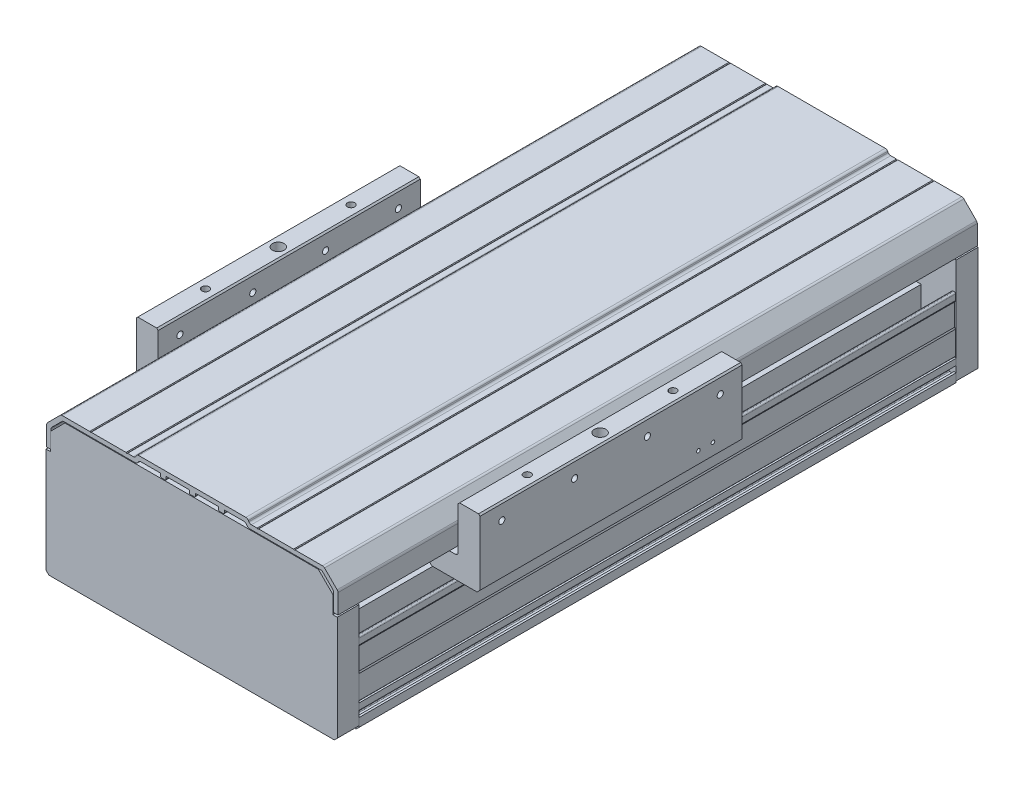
SolidWorks part; units mm, degrees
ref_plane "정면" through (0, 0, 0) normal (0, 0, 1) x (1, 0, 0)
ref_plane "윗면" through (0, 0, 0) normal (0, 1, 0) x (1, 0, 0)
ref_plane "우측면" through (0, 0, 0) normal (1, 0, 0) x (0, 0, -1)
sketch "스케치1" plane through (0, 0, 0) normal (0, 0, 1) x (1, 0, 0)
  line L0 (-99, 33.5) -> (-99, 48.5)
  line L1 (-97, 16.5) -> (-97, 53.5)
  line L2 (-99.5, 16.5) -> (-99.5, 32.5)
  line L3 (-97.5, 16) -> (-99, 16)
  line L4 (-99, 33.5) -> (-99.5, 32.5)
  line L5 (-98.5, 54.5) -> (-98, 54.5)
  line L6 (-99.5, 49.5) -> (-99.5, 53.5)
  line L7 (-99, 48.5) -> (-99.5, 49.5)
  line L8 (99, 33.5) -> (99, 48.5)
  line L9 (97, 16.5) -> (97, 53.5)
  line L10 (99.5, 16.5) -> (99.5, 32.5)
  line L11 (97.5, 16) -> (99, 16)
  line L12 (99, 33.5) -> (99.5, 32.5)
  line L13 (98.5, 54.5) -> (98, 54.5)
  line L14 (99.5, 49.5) -> (99.5, 53.5)
  line L15 (99, 48.5) -> (99.5, 49.5)
  line L16 (-78, 44.5) -> (-43.5, 44.5)
  line L17 (-36, -1) -> (-98, -1)
  line L18 (-66.55, 32.5) -> (-54.5, 32.5)
  line L19 (-100, 1) -> (-98, -1)
  line L20 (-78, 44.5) -> (-78, 37.5)
  line L21 (-69.5, 14.5) -> (-69.5, 30.0927)
  line L22 (-77.7, 37) -> (-78, 36.5)
  line L23 (-78, 37.5) -> (-77.7, 37)
  line L24 (-78, 26.5) -> (-77.1807, 25.0809)
  line L25 (-78, 36.5) -> (-78, 26.5)
  line L26 (-97, 21) -> (-97, 15.5)
  line L27 (-97, 25.5) -> (-97, 22)
  line L28 (-97, 15.5) -> (-100, 15.5)
  line L29 (36, -1) -> (98, -1)
  line L30 (35, 0) -> (-35, 0)
  line L31 (-35, 0) -> (-36, -1)
  line L32 (36, -1) -> (35, 0)
  line L33 (100, 1) -> (98, -1)
  line L34 (-16.9019, 9.5) -> (-14.3038, 11)
  line L35 (-14.3038, 5) -> (-16.9019, 6.5)
  line L36 (-22.5, 16) -> (22.5, 16)
  line L37 (-23, 16.5) -> (-22.5, 16)
  line L38 (-16.9019, 9.5) -> (-18.0629, 9.5)
  line L39 (-16.9019, 6.5) -> (-18.0629, 6.5)
  line L40 (-52.5, 30.5) -> (-52.5, 16.25)
  line L41 (-52, 15.75) -> (-51.4079, 15.75)
  line L42 (-51.6685, 12.5) -> (-67.5, 12.5)
  line L43 (-38.5, 16.5) -> (-23, 16.5)
  line L44 (22.5, 16) -> (23, 16.5)
  line L45 (23, 16.5) -> (38.5, 16.5)
  line L46 (16.9019, 9.5) -> (14.3038, 11)
  line L47 (14.3038, 5) -> (16.9019, 6.5)
  line L48 (16.9019, 9.5) -> (18.0629, 9.5)
  line L49 (16.9019, 6.5) -> (18.0629, 6.5)
  line L50 (-4, 9) -> (4, 9)
  line L51 (-7.3333, 11) -> (-4, 9)
  line L52 (7.3333, 11) -> (4, 9)
  line L53 (-14.3038, 11) -> (-7.3333, 11)
  line L54 (-14.3038, 5) -> (14.3038, 5)
  line L55 (7.3333, 11) -> (14.3038, 11)
  line L56 (43.5, 22.5) -> (43.5, 44.5)
  line L57 (97, 21) -> (97, 15.5)
  line L58 (97, 15.5) -> (100, 15.5)
  line L59 (97, 25.5) -> (97, 22)
  line L60 (95, 25.5) -> (97, 25.5)
  line L61 (95, 24) -> (95, 25.5)
  line L62 (71, 47.5) -> (71, 44.5)
  line L63 (71, 47.5) -> (76, 47.5)
  line L64 (71, 44.5) -> (43.5, 44.5)
  line L65 (100, 1) -> (100, 6.85)
  line L66 (98.5, 11.15) -> (100, 11.15)
  line L67 (98.5, 12.65) -> (98.5, 11.15)
  line L68 (95.5, 12.65) -> (98.5, 12.65)
  line L69 (95, 5.85) -> (95, 12.15)
  line L70 (98.5, 5.35) -> (95.5, 5.35)
  line L71 (98.5, 6.85) -> (98.5, 5.35)
  line L72 (100, 6.85) -> (98.5, 6.85)
  line L73 (100, 11.15) -> (100, 15.5)
  line L74 (-100, 1) -> (-100, 6.85)
  line L75 (-98.5, 11.15) -> (-100, 11.15)
  line L76 (-98.5, 12.65) -> (-98.5, 11.15)
  line L77 (-95.5, 12.65) -> (-98.5, 12.65)
  line L78 (-95, 5.85) -> (-95, 12.15)
  line L79 (-98.5, 5.35) -> (-95.5, 5.35)
  line L80 (-98.5, 6.85) -> (-98.5, 5.35)
  line L81 (-100, 6.85) -> (-98.5, 6.85)
  line L82 (-100, 11.15) -> (-100, 15.5)
  line L83 (38.5, 17.5) -> (38.5, 16.5)
  line L84 (-43.5, 22.5) -> (-43.5, 44.5)
  line L85 (-38.5, 17.5) -> (-38.5, 16.5)
  line L86 (80.8, 21) -> (79.5, 21)
  line L87 (79.5, 18) -> (93.5, 18)
  line L88 (79.5, 21) -> (79.5, 18)
  line L89 (92, 21.2) -> (92, 22.8)
  line L90 (92.2, 21) -> (92, 21.2)
  line L91 (93.5, 21) -> (92.2, 21)
  line L92 (92.2, 23) -> (94, 23)
  line L93 (92, 22.8) -> (92.2, 23)
  line L94 (93.5, 18) -> (93.5, 21)
  line L95 (81, 22.8) -> (81, 21.2)
  line L96 (81, 21.2) -> (80.8, 21)
  line L97 (80.8, 23) -> (81, 22.8)
  line L98 (78.4, 23) -> (80.8, 23)
  line L99 (-95, 25.5) -> (-97, 25.5)
  line L100 (-95, 24) -> (-95, 25.5)
  line L101 (-80.8, 21) -> (-79.5, 21)
  line L102 (-79.5, 18) -> (-93.5, 18)
  line L103 (-79.5, 21) -> (-79.5, 18)
  line L104 (-92, 21.2) -> (-92, 22.8)
  line L105 (-92.2, 21) -> (-92, 21.2)
  line L106 (-93.5, 21) -> (-92.2, 21)
  line L107 (-92.2, 23) -> (-94, 23)
  line L108 (-92, 22.8) -> (-92.2, 23)
  line L109 (-93.5, 18) -> (-93.5, 21)
  line L110 (-81, 22.8) -> (-81, 21.2)
  line L111 (-81, 21.2) -> (-80.8, 21)
  line L112 (-80.8, 23) -> (-81, 22.8)
  line L113 (-78.4, 23) -> (-80.8, 23)
  line L114 (76, 47.5) -> (76, 31.4999)
  line L115 (76, 31.4999) -> (76.3, 31.4999)
  line L116 (76.3, 31.4999) -> (76.3, 24.581)
  line L117 (-97, 22) -> (-96.7, 21.5)
  line L118 (-96.7, 21.5) -> (-97, 21)
  line L119 (97, 22) -> (96.7, 21.5)
  line L120 (96.7, 21.5) -> (97, 21)
  line L121 (66.55, 32.5) -> (54.5, 32.5)
  line L122 (69.5, 14.5) -> (69.5, 30.0927)
  line L123 (52.5, 30.5) -> (52.5, 16.25)
  line L124 (52, 15.75) -> (51.4079, 15.75)
  line L125 (51.6685, 12.5) -> (67.5, 12.5)
  arc A0 (-99.5, 16.5) -> (-99, 16) centre (-99, 16.5) ccw
  arc A1 (-97.5, 16) -> (-97, 16.5) centre (-97.5, 16.5) ccw
  arc A2 (-98.5, 54.5) -> (-99.5, 53.5) centre (-98.5, 53.5) ccw
  arc A3 (-97, 53.5) -> (-98, 54.5) centre (-98, 53.5) ccw
  arc A4 (99, 16) -> (99.5, 16.5) centre (99, 16.5) ccw
  arc A5 (97, 16.5) -> (97.5, 16) centre (97.5, 16.5) ccw
  arc A6 (99.5, 53.5) -> (98.5, 54.5) centre (98.5, 53.5) ccw
  arc A7 (98, 54.5) -> (97, 53.5) centre (98, 53.5) ccw
  arc A8 (-69.5, 14.5) -> (-67.5, 12.5) centre (-67.5, 14.5) ccw
  arc A9 (-77.4769, 22.3846) -> (-76.1936, 24.5882) centre (-76, 23) ccw
  arc A10 (-77.4769, 22.3846) -> (-78.4, 23) centre (-78.4, 22) ccw
  arc A11 (-67.05, 33) -> (-66.55, 32.5) centre (-66.55, 33) ccw
  arc A12 (-77.1807, 25.0809) -> (-76.1936, 24.5882) centre (-76.3147, 25.5809) ccw
  arc A13 (-69.5, 30.0927) -> (-69.9153, 30.5854) centre (-70, 30.0927) ccw
  arc A14 (-18.0629, 9.5) -> (-18.0629, 6.5) centre (-20, 8) ccw
  arc A15 (-52.5, 16.25) -> (-52, 15.75) centre (-52, 16.25) ccw
  arc A16 (-51.4079, 15.75) -> (-51.0845, 15.8686) centre (-51.4079, 16.25) ccw
  arc A17 (-51.301, 12.339) -> (-51.0845, 15.8686) centre (-49.5, 14) ccw
  arc A18 (-51.301, 12.339) -> (-51.6685, 12.5) centre (-51.6685, 12) ccw
  arc A19 (-52.5, 30.5) -> (-54.5, 32.5) centre (-54.5, 30.5) ccw
  arc A20 (18.0629, 6.5) -> (18.0629, 9.5) centre (20, 8) ccw
  arc A21 (38.5, 17.5) -> (43.5, 22.5) centre (38.5, 22.5) ccw
  arc A22 (78.4, 23) -> (77.4769, 22.3846) centre (78.4, 22) ccw
  arc A23 (94, 23) -> (95, 24) centre (94, 24) ccw
  arc A24 (95.5, 12.65) -> (95, 12.15) centre (95.5, 12.15) ccw
  arc A25 (95, 5.85) -> (95.5, 5.35) centre (95.5, 5.85) ccw
  arc A26 (-95, 12.15) -> (-95.5, 12.65) centre (-95.5, 12.15) ccw
  arc A27 (-95.5, 5.35) -> (-95, 5.85) centre (-95.5, 5.85) ccw
  arc A28 (-43.5, 22.5) -> (-38.5, 17.5) centre (-38.5, 22.5) ccw
  arc A29 (-67.05, 33) -> (-69.9153, 30.5854) centre (-69.5, 33) ccw
  arc A30 (-95, 24) -> (-94, 23) centre (-94, 24) ccw
  arc A31 (76.1936, 24.5882) -> (77.4769, 22.3846) centre (76, 23) ccw
  arc A32 (76.1936, 24.5882) -> (76.3, 24.581) centre (76.3147, 25.5809) ccw
  arc A33 (67.5, 12.5) -> (69.5, 14.5) centre (67.5, 14.5) ccw
  arc A34 (66.55, 32.5) -> (67.05, 33) centre (66.55, 33) ccw
  arc A35 (69.9153, 30.5854) -> (69.5, 30.0927) centre (70, 30.0927) ccw
  arc A36 (52, 15.75) -> (52.5, 16.25) centre (52, 16.25) ccw
  arc A37 (51.0845, 15.8686) -> (51.4079, 15.75) centre (51.4079, 16.25) ccw
  arc A38 (51.0845, 15.8686) -> (51.301, 12.339) centre (49.5, 14) ccw
  arc A39 (51.6685, 12.5) -> (51.301, 12.339) centre (51.6685, 12) ccw
  arc A40 (54.5, 32.5) -> (52.5, 30.5) centre (54.5, 30.5) ccw
  arc A41 (69.9153, 30.5854) -> (67.05, 33) centre (69.5, 33) ccw
extrude "보스-돌출1" add sketch "스케치1" along normal mid plane 410 contours A31 A32 L116 L115 L114 L63 L62 L64 L56 A21 L83 L45 L44 L36 L37 L43 L85 A28 L84 L16 L20 L23 L22 L25 L24 A12 A9 A10 L113 L112 L110 L111 L101 L103 L102 L109 L106 L105 L104 L108 L107 A30 L100 L99 L1 L117 L118 L26 L28 L82 | L9 A7 L13 A6 L14 L15 L8 L12 L10 A4 L11 A5
sketch "스케치2" plane through (0, 0, 205) normal (0, 0, 1) x (1, 0, 0)
  line L0 (97, 86) -> (87, 96)
  line L1 (-98, 0) -> (98, 0)
  line L2 (-87, 96) -> (87, 96)
  line L3 (-100, 74) -> (-100, 2)
  line L4 (-100, 2) -> (-98, 0)
  line L5 (-97, 86) -> (-87, 96)
  line L6 (-97, 86) -> (-97, 74)
  line L7 (-100, 74) -> (-97, 74)
  line L8 (100, 74) -> (100, 2)
  line L9 (100, 2) -> (98, 0)
  line L10 (97, 86) -> (97, 74)
  line L11 (97, 74) -> (100, 74)
extrude "보스-돌출2" add sketch "스케치2" along normal blind 15 separate body
sketch "스케치3" plane through (0, 0, -205) normal (0, 0, -1) x (-1, 0, 0)
  line L0 (97, 86) -> (87, 96)
  line L1 (-98, 0) -> (98, 0)
  line L2 (-87, 96) -> (87, 96)
  line L3 (-100, 74) -> (-100, 2)
  line L4 (-100, 2) -> (-98, 0)
  line L5 (-97, 86) -> (-87, 96)
  line L6 (-97, 86) -> (-97, 74)
  line L7 (-100, 74) -> (-97, 74)
  line L8 (100, 74) -> (100, 2)
  line L9 (100, 2) -> (98, 0)
  line L10 (97, 86) -> (97, 74)
  line L11 (97, 74) -> (100, 74)
extrude "보스-돌출3" add sketch "스케치3" along normal blind 15 separate body
ref_plane "평면1" through (0, 0, 140) normal (0, 0, 1) x (1, 0, 0)
sketch "스케치4" plane through (0, 0, 140) normal (0, 0, 1) x (1, 0, 0)
  line L0 (0, 0) -> (0, 72.5) construction
  line L1 (35, 0) -> (-35, 0) construction
  line L2 (104, 104) -> (103, 103)
  line L3 (103, 103) -> (103, 74)
  line L4 (101, 72) -> (96, 72)
  line L5 (94, 74) -> (94, 77.5)
  line L6 (84, 87.5) -> (58.5, 87.5)
  line L7 (58.5, 87.5) -> (56.5, 89.5)
  line L8 (56.5, 89.5) -> (-56.5, 89.5)
  line L9 (-56.5, 89.5) -> (-58.5, 87.5)
  line L10 (-58.5, 87.5) -> (-84, 87.5)
  line L11 (-94, 77.5) -> (-94, 74)
  line L12 (-96, 72) -> (-101, 72)
  line L13 (-103, 74) -> (-103, 103)
  line L14 (-103, 103) -> (-104, 104)
  line L15 (83, 72.5) -> (-83, 72.5)
  line L16 (-118, 59) -> (-118, 103)
  line L17 (-118, 59) -> (-118, 103)
  line L18 (-116, 57) -> (-85, 57)
  line L19 (-118, 59) -> (-116, 57)
  line L20 (-85, 57) -> (-83, 59)
  line L21 (-83, 59) -> (-83, 72.5)
  line L22 (-117, 104) -> (-104, 104)
  line L23 (-117, 104) -> (-118, 103)
  line L26 (83, 72.5) -> (83, 59)
  line L27 (84, 87.5) -> (58.5, 87.5)
  line L28 (118, 59) -> (118, 103)
  line L29 (85, 57) -> (116, 57)
  line L30 (116, 57) -> (118, 59)
  line L31 (117, 104) -> (104, 104)
  line L32 (118, 103) -> (117, 104)
  line L33 (81.75, 87.5) -> (84, 87.5)
  line L34 (83, 59) -> (85, 57)
  arc A0 (101, 72) -> (103, 74) centre (101, 74) ccw
  arc A1 (94, 74) -> (96, 72) centre (96, 74) ccw
  arc A2 (94, 77.5) -> (84, 87.5) centre (84, 77.5) ccw
  arc A3 (-84, 87.5) -> (-94, 77.5) centre (-84, 77.5) ccw
  arc A4 (-96, 72) -> (-94, 74) centre (-96, 74) ccw
  arc A5 (-103, 74) -> (-101, 72) centre (-101, 74) ccw
  dimension "D1" = 72.5
extrude "보스-돌출4" add sketch "스케치4" against normal blind 180 separate body contours A5 L13 L14 L22 L23 L16 L19 L18 L20 L21 L15 L26 L34 L29 L30 L28 L32 L31 L2 L3 A0 L4 A1 L5 A2 L6 L27 L7 L8 L9 L10 A3 L11 A4 L12
sketch "스케치5" plane through (0, 0, 0) normal (0, 0, 1) x (1, 0, 0)
  line L0 (0, 0) -> (0, 101.5) construction
  line L1 (-98, 0) -> (98, 0) construction
  line L2 (36.7494, 101.5) -> (-36.7494, 101.5)
  line L3 (-45.5, 99) -> (-69.5, 99)
  line L4 (-88.1265, 96) -> (-39.2151, 96)
  line L5 (-90.7833, 98.4142) -> (-99.4142, 89.7833)
  line L6 (-96.4142, 88.5407) -> (-89.5407, 95.4142)
  line L7 (-100, 75) -> (-97, 75)
  line L8 (-97, 75) -> (-97, 87.1265)
  line L9 (-100, 88.3691) -> (-100, 75)
  line L10 (-70.5, 99) -> (-89.3691, 99)
  line L11 (-70, 98.7) -> (-70.5, 99)
  line L12 (-69.5, 99) -> (-70, 98.7)
  line L13 (-37.518, 96.9417) -> (-37.1335, 97.5583)
  line L14 (-40.528, 99) -> (-44.5, 99)
  line L15 (-45, 98.7) -> (-45.5, 99)
  line L16 (-44.5, 99) -> (-45, 98.7)
  line L17 (-38.4465, 100.5583) -> (-38.831, 99.9417)
  line L18 (2.25, 98.5) -> (17.75, 98.5)
  line L19 (-18, 96.75) -> (-18, 98.25)
  line L20 (-22, 98.25) -> (-22, 96.75)
  line L21 (-21.25, 96) -> (-18.75, 96)
  line L22 (2, 96.75) -> (2, 98.25)
  line L23 (-1.25, 96) -> (1.25, 96)
  line L24 (-2, 98.25) -> (-2, 96.75)
  line L25 (-17.75, 98.5) -> (-2.25, 98.5)
  line L26 (-35.4364, 98.5) -> (-22.25, 98.5)
  line L27 (22, 96.75) -> (22, 98.25)
  line L28 (18.75, 96) -> (21.25, 96)
  line L29 (18, 98.25) -> (18, 96.75)
  line L30 (22.25, 98.5) -> (35.4364, 98.5)
  line L31 (89.3691, 99) -> (70.5, 99)
  line L32 (39.2151, 96) -> (88.1265, 96)
  line L33 (37.1335, 97.5583) -> (37.518, 96.9417)
  line L34 (69.5, 99) -> (45.5, 99)
  line L35 (38.831, 99.9417) -> (38.4465, 100.5583)
  line L36 (44.5, 99) -> (40.528, 99)
  line L37 (45, 98.7) -> (44.5, 99)
  line L38 (45.5, 99) -> (45, 98.7)
  line L39 (70, 98.7) -> (69.5, 99)
  line L40 (70.5, 99) -> (70, 98.7)
  line L41 (99.4142, 89.7833) -> (90.7833, 98.4142)
  line L42 (97, 75) -> (100, 75)
  line L43 (89.5407, 95.4142) -> (96.4142, 88.5407)
  line L44 (97, 87.1265) -> (97, 75)
  line L45 (100, 75) -> (100, 88.3691)
  arc A0 (-88.1265, 96) -> (-89.5407, 95.4142) centre (-88.1265, 94) ccw
  arc A1 (-96.4142, 88.5407) -> (-97, 87.1265) centre (-95, 87.1265) ccw
  arc A2 (-99.4142, 89.7833) -> (-100, 88.3691) centre (-98, 88.3691) ccw
  arc A3 (-89.3691, 99) -> (-90.7833, 98.4142) centre (-89.3691, 97) ccw
  arc A4 (-35.4364, 98.5) -> (-37.1335, 97.5583) centre (-35.4364, 96.5) ccw
  arc A5 (-39.2151, 96) -> (-37.518, 96.9417) centre (-39.2151, 98) ccw
  arc A6 (-36.7494, 101.5) -> (-38.4465, 100.5583) centre (-36.7494, 99.5) ccw
  arc A7 (-40.528, 99) -> (-38.831, 99.9417) centre (-40.528, 101) ccw
  arc A8 (2.25, 98.5) -> (2, 98.25) centre (2.25, 98.25) ccw
  arc A9 (-2, 98.25) -> (-2.25, 98.5) centre (-2.25, 98.25) ccw
  arc A10 (-17.75, 98.5) -> (-18, 98.25) centre (-17.75, 98.25) ccw
  arc A11 (-22, 98.25) -> (-22.25, 98.5) centre (-22.25, 98.25) ccw
  arc A12 (-18.75, 96) -> (-18, 96.75) centre (-18.75, 96.75) ccw
  arc A13 (-22, 96.75) -> (-21.25, 96) centre (-21.25, 96.75) ccw
  arc A14 (1.25, 96) -> (2, 96.75) centre (1.25, 96.75) ccw
  arc A15 (-2, 96.75) -> (-1.25, 96) centre (-1.25, 96.75) ccw
  arc A16 (22.25, 98.5) -> (22, 98.25) centre (22.25, 98.25) ccw
  arc A17 (18, 98.25) -> (17.75, 98.5) centre (17.75, 98.25) ccw
  arc A18 (21.25, 96) -> (22, 96.75) centre (21.25, 96.75) ccw
  arc A19 (18, 96.75) -> (18.75, 96) centre (18.75, 96.75) ccw
  arc A20 (37.1335, 97.5583) -> (35.4364, 98.5) centre (35.4364, 96.5) ccw
  arc A21 (37.518, 96.9417) -> (39.2151, 96) centre (39.2151, 98) ccw
  arc A22 (38.4465, 100.5583) -> (36.7494, 101.5) centre (36.7494, 99.5) ccw
  arc A23 (38.831, 99.9417) -> (40.528, 99) centre (40.528, 101) ccw
  arc A24 (89.5407, 95.4142) -> (88.1265, 96) centre (88.1265, 94) ccw
  arc A25 (97, 87.1265) -> (96.4142, 88.5407) centre (95, 87.1265) ccw
  arc A26 (100, 88.3691) -> (99.4142, 89.7833) centre (98, 88.3691) ccw
  arc A27 (90.7833, 98.4142) -> (89.3691, 99) centre (89.3691, 97) ccw
  dimension "D1" = 101.5
extrude "보스-돌출5" add sketch "스케치5" along normal mid plane 439 separate body
hole_wizard "M8 육각 머리 볼트용 카운터보어1" positions "스케치8" profile "스케치7" counterbore size "M8" standard "ISO"
sketch "스케치8" plane through (0, 18, 0) normal (0, 1, 0) x (-1, 0, 0)
  line L0 (-35, 205) -> (35, 205) construction
  line L1 (-36, 205) -> (-98, 205) construction
  point P0 (86.5, 120)
  point P1 (-86.5, 120)
  point P8 (0, 205)
  dimension "D1" = 173
  dimension "D2" = 86.5
  dimension "D3" = 85
sketch "스케치7" plane through (-86.5, 18, 120) normal (1, 0, 0) x (0, 0, 1)
  line L0 (0, 0) -> (0, 19)
  line L1 (0, 19) -> (4.5, 19)
  line L3 (4.5, 19) -> (4.5, 9)
  line L4 (4.5, 9) -> (7, 9)
  line L5 (7, 9) -> (7, 0)
  line L7 (7, 0) -> (0, 0)
  line L11 (0, -6.35) -> (0, 107.95) construction
  dimension "관통 구멍 지름" = 9
  dimension "관통 구멍 깊이" = 19
  dimension "카운터보어 지름" = 14
  dimension "카운터보어 깊이" = 9
pattern_linear "선형 패턴1" count 2 spacing 240 along (0, 0, -1) of "M8 육각 머리 볼트용 카운터보어1"
hole_wizard "M6 나사 구멍1" positions "스케치10" profile "스케치9" tap size "M6" standard "ISO"
sketch "스케치10" plane through (0, 104, 0) normal (0, 1, 0) x (-1, 0, 0)
  line L0 (-117, 140) -> (-104, 140) construction
  line L1 (-118, -40) -> (-118, 140) construction
  point P0 (-110.5, 100)
  point P1 (-110.5, 0)
  dimension "D1" = 100
  dimension "D2" = 40
  dimension "D3" = 7.5
sketch "스케치9" plane through (110.5, 104, 100) normal (1, 0, 0) x (0, 0, 1)
  line L0 (0, 0) -> (0, 24.5022)
  line L1 (0, 24.5022) -> (2.5, 23)
  line L2 (2.5, 23) -> (2.5, 0)
  line L5 (2.5, 0) -> (0, 0)
  line L10 (0, 24.5022) -> (-2.5, 23) construction
  line L11 (0, -6.35) -> (0, 107.95) construction
  dimension "탭 드릴 지름" = 5
  dimension "탭 드릴 깊이" = 23
  dimension "드릴 각도" = 118
hole_wizard "M5 나사 구멍1" positions "스케치12" profile "스케치11" tap size "M5" standard "ISO"
sketch "스케치12" plane through (118, 0, 0) normal (1, 0, 0) x (0, 0, -1)
  line L0 (40, 104) -> (-140, 104) construction
  line L1 (-140, 59) -> (-140, 103) construction
  point P0 (-125, 93)
  point P1 (-75, 93)
  point P3 (-25, 93)
  point P5 (25, 93)
  dimension "D1" = 11
  dimension "D2" = 15
  dimension "D3" = 50
  dimension "D4" = 50
  dimension "D5" = 50
sketch "스케치11" plane through (118, 93, 125) normal (0, 1, 0) x (0, 0, -1)
  line L0 (0, 0) -> (0, 17.2618)
  line L1 (0, 17.2618) -> (2.1, 16)
  line L2 (2.1, 16) -> (2.1, 0)
  line L5 (2.1, 0) -> (0, 0)
  line L10 (0, 17.2618) -> (-2.1, 16) construction
  line L11 (0, -6.35) -> (0, 107.95) construction
  dimension "탭 드릴 지름" = 4.2
  dimension "탭 드릴 깊이" = 16
  dimension "드릴 각도" = 118
sketch "스케치13" plane through (0, 104, 0) normal (0, 1, 0) x (1, 0, 0)
  line L0 (118, 40) -> (118, -140) construction
  line L1 (117, -140) -> (104, -140) construction
  circle A0 centre (110.5, -50) radius 2.5
  dimension "D1" = 5
  dimension "D2" = 7.5
  dimension "D3" = 90
extrude "컷-돌출1" cut sketch "스케치13" against normal up to next (47 mm away)
sketch "스케치14" plane through (0, 104, 0) normal (0, 1, 0) x (1, 0, 0)
  circle A0 centre (110.5, -50) radius 4
  dimension "D1" = 8
extrude "컷-돌출2" cut sketch "스케치14" against normal blind 18
mirror "대칭 복사1" about plane through (0, 0, 0) normal (1, 0, 0) of "컷-돌출2", "컷-돌출1", "M5 나사 구멍1", "M6 나사 구멍1"
hole_wizard "M3 나사 구멍1" positions "스케치16" profile "스케치15" tap size "M3" standard "ISO"
sketch "스케치16" plane through (118, 0, 0) normal (1, 0, 0) x (0, 0, -1)
  line L0 (40, 59) -> (40, 103) construction
  line L1 (40, 57) -> (-140, 57) construction
  point P0 (20, 67)
  point P1 (10, 67)
  dimension "D1" = 20
  dimension "D2" = 10
  dimension "D3" = 10
sketch "스케치15" plane through (118, 67, -20) normal (0, 1, 0) x (0, 0, -1)
  line L0 (0, 0) -> (0, 13.2511)
  line L1 (0, 13.2511) -> (1.25, 12.5)
  line L2 (1.25, 12.5) -> (1.25, 0)
  line L5 (1.25, 0) -> (0, 0)
  line L10 (0, 13.2511) -> (-1.25, 12.5) construction
  line L11 (0, -6.35) -> (0, 107.95) construction
  dimension "탭 드릴 지름" = 2.5
  dimension "탭 드릴 깊이" = 12.5
  dimension "드릴 각도" = 118
mirror "대칭 복사2" about plane through (0, 0, 0) normal (1, 0, 0) of "M3 나사 구멍1"
